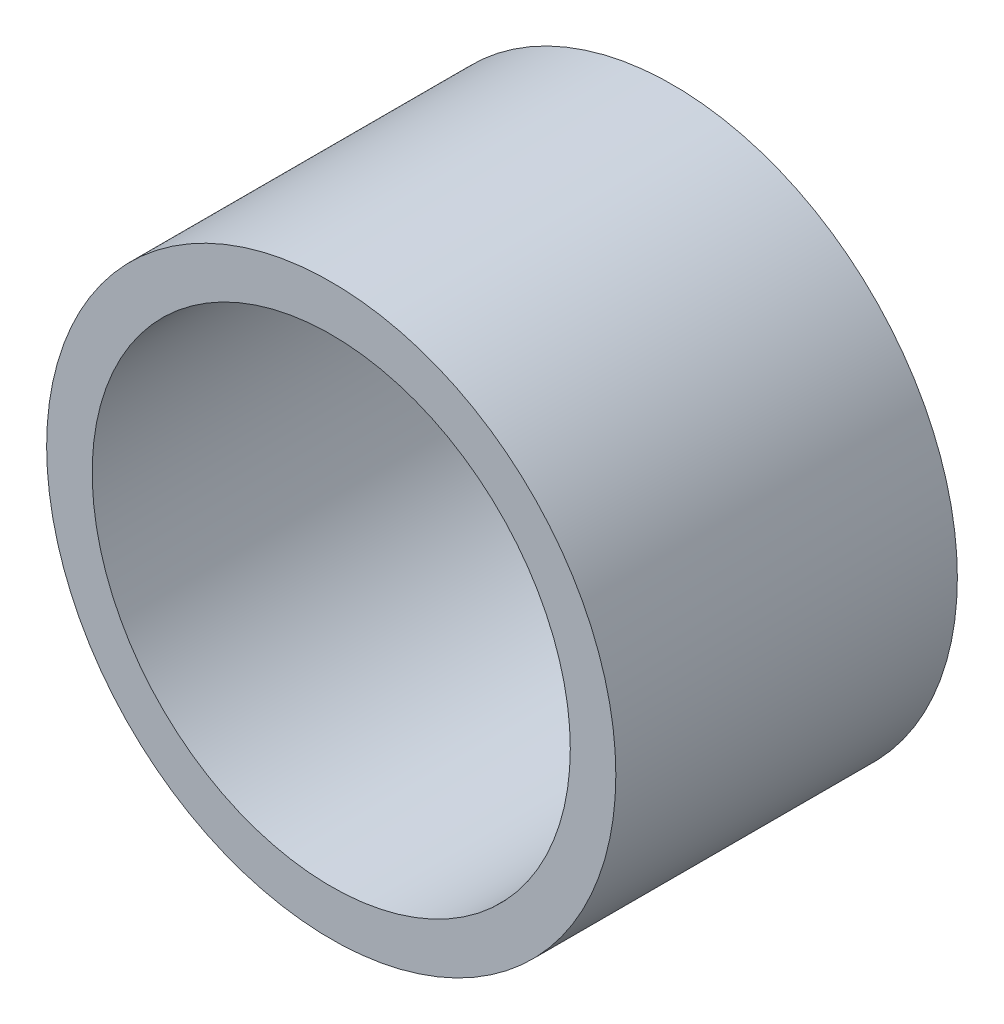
SolidWorks part; units mm, degrees
ref_plane "Plan de face" through (0, 0, 0) normal (0, 0, 1) x (1, 0, 0)
ref_plane "Plan de dessus" through (0, 0, 0) normal (0, 1, 0) x (1, 0, 0)
ref_plane "Plan de droite" through (0, 0, 0) normal (1, 0, 0) x (0, 0, -1)
sketch "Esquisse1" plane through (0, 0, 0) normal (0, 0, 1) x (1, 0, 0)
  circle A0 centre (0, 0) radius 10.5
  circle A1 centre (0, 0) radius 12.5
  dimension "D1" = 21
  dimension "D2" = 25
extrude "Extrusion1" add sketch "Esquisse1" along normal blind 15
